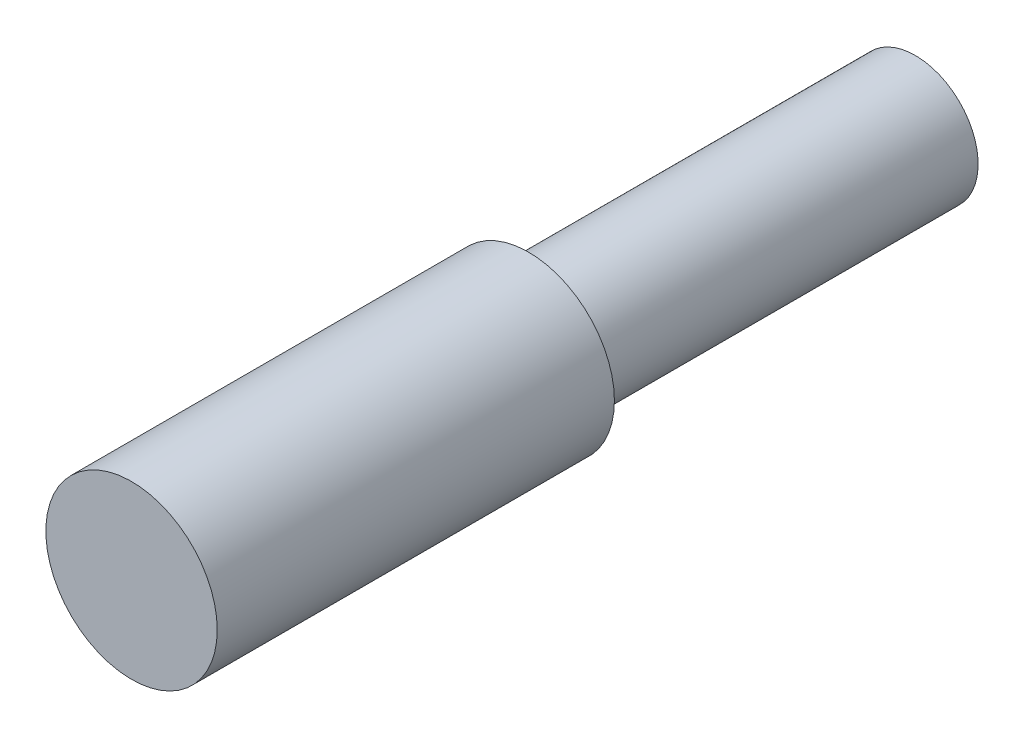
SolidWorks part; units mm, degrees
ref_plane "Front" through (0, 0, 0) normal (0, 0, 1) x (1, 0, 0)
ref_plane "Top" through (0, 0, 0) normal (0, 1, 0) x (1, 0, 0)
ref_plane "Right" through (0, 0, 0) normal (1, 0, 0) x (0, 0, -1)
sketch "Sketch1" plane through (0, 0, 0) normal (0, 0, 1) x (1, 0, 0)
  circle A0 centre (0, 0) radius 1.524
  dimension "D1" = 3.048
extrude "Extrude1" add sketch "Sketch1" along normal blind 19.05
sketch "Sketch2" plane through (0, 0, 19.05) normal (0, 0, 1) x (1, 0, 0)
  circle A0 centre (0, 0) radius 2.0828
  circle A1 centre (0, 0) radius 1.524 construction
  dimension "D1" = 4.1656
extrude "Extrude2" add sketch "Sketch2" against normal blind 9.652
